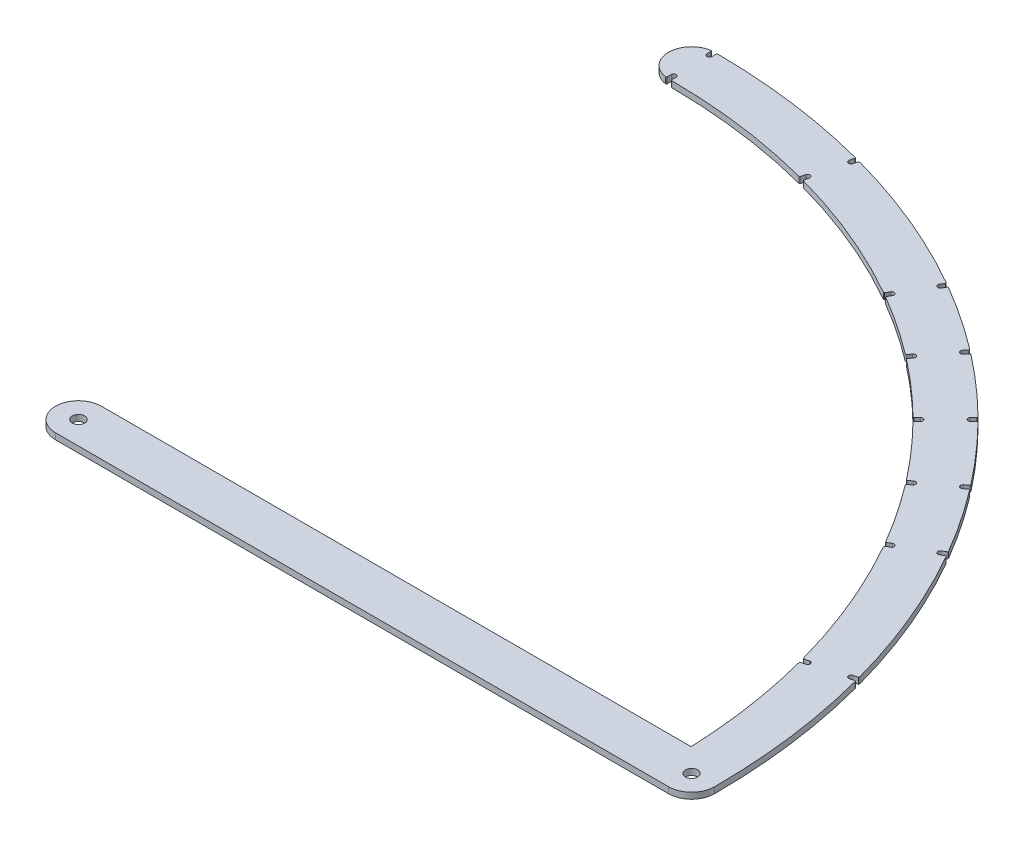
SolidWorks part; units mm, degrees
other "<Rotaladef01>-<Estrusione-Estrusione1>"
ref_plane "Piano frontale" through (0, 0, 0) normal (0, 0, 1) x (1, 0, 0)
ref_plane "Piano superiore" through (0, 0, 0) normal (0, 1, 0) x (1, 0, 0)
ref_plane "Piano destro" through (0, 0, 0) normal (1, 0, 0) x (0, 0, -1)
mirrored part "Rotaladef01_Specchiato"
